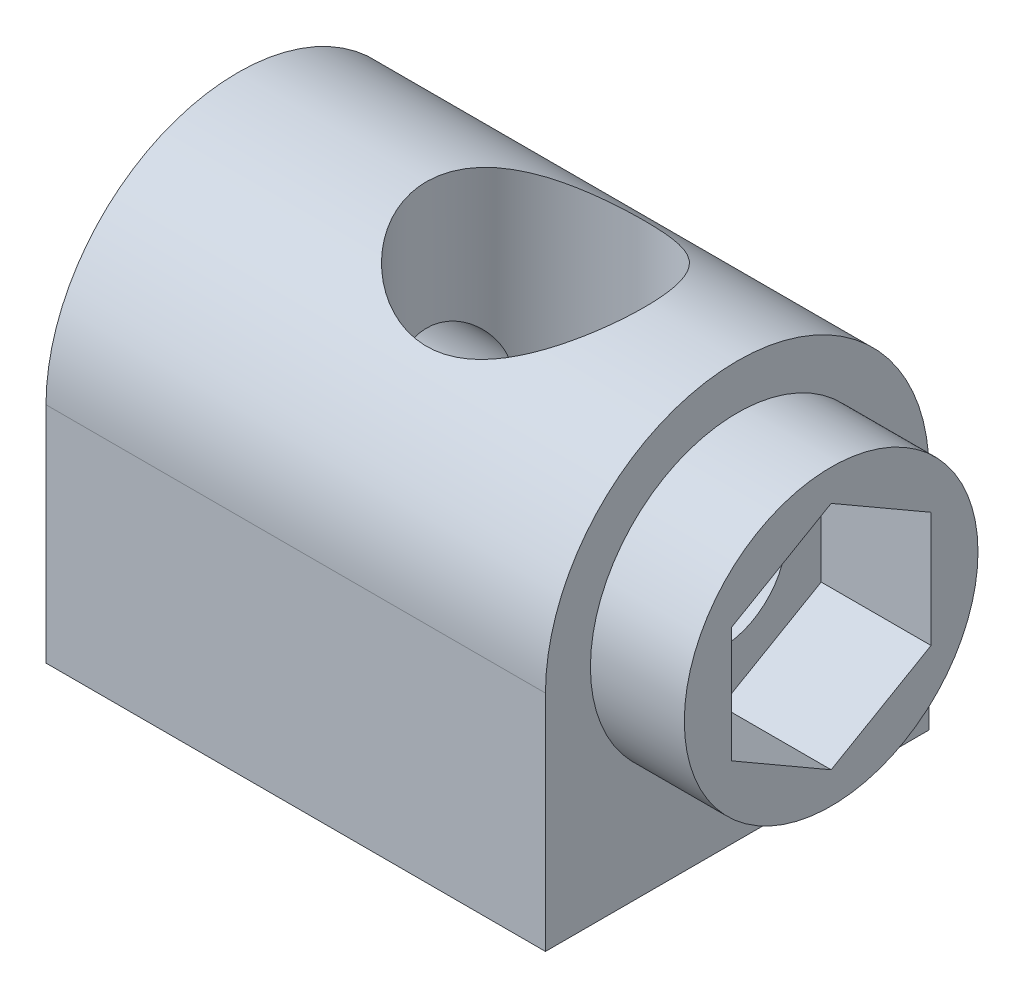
SolidWorks part; units mm, degrees
ref_plane "Front Plane" through (0, 0, 0) normal (0, 0, 1) x (1, 0, 0)
ref_plane "Top Plane" through (0, 0, 0) normal (0, 1, 0) x (1, 0, 0)
ref_plane "Right Plane" through (0, 0, 0) normal (1, 0, 0) x (0, 0, -1)
sketch "Sketch1" plane through (0, 0, 0) normal (1, 0, 0) x (0, 0, -1)
  line L0 (-9.6, 0) -> (9.6, 0)
  line L1 (9.6, 0) -> (9.6, 11.2)
  line L2 (-9.6, 11.2) -> (-9.6, 0)
  arc A0 (9.6, 11.2) -> (-9.6, 11.2) centre (0, 11.2) ccw
  point P4 (0, 0)
  dimension "D1" = 19.2
  dimension "D2" = 20.8
extrude "Boss-Extrude1" add sketch "Sketch1" along normal blind 25
sketch "Sketch2" plane through (25, 0, 0) normal (1, 0, 0) x (0, 0, -1)
  circle A0 centre (0, 11.2) radius 7.35
  dimension "D1" = 14.7
extrude "Boss-Extrude2" add sketch "Sketch2" along normal blind 4.7
sketch "Sketch3" plane through (0, 0, 0) normal (-1, 0, 0) x (0, 0, 1)
  circle A0 centre (0, 11.2) radius 4.9
  dimension "D1" = 9.8
extrude "Cut-Extrude2" cut sketch "Sketch3" against normal blind 5
sketch "Sketch4" plane through (29.7, 0, 0) normal (1, 0, 0) x (0, 0, -1)
  line L1 (0, 5.4265) -> (5, 8.3132)
  line L2 (5, 8.3132) -> (5, 14.0868)
  line L3 (5, 14.0868) -> (0, 16.9735)
  line L4 (0, 16.9735) -> (-5, 14.0868)
  line L5 (-5, 14.0868) -> (-5, 8.3132)
  line L6 (-5, 8.3132) -> (0, 5.4265)
  circle A0 centre (0, 11.2) radius 5 construction
  dimension "D1" = 10
extrude "Cut-Extrude3" cut sketch "Sketch4" against normal blind 5.5
sketch "Sketch5" plane through (5, 0, 0) normal (-1, 0, 0) x (0, 0, 1)
  circle A0 centre (0, 11.2) radius 3.25
  dimension "D1" = 6.5
extrude "Cut-Extrude4" cut sketch "Sketch5" against normal through all
sketch "Sketch6" plane through (0, 0, 0) normal (0, -1, 0) x (1, 0, 0)
  line L0 (25, -7.35) -> (25, 7.35) construction
  circle A0 centre (14.9, 0) radius 3.4
  dimension "D1" = 6.8
  dimension "D2" = 10.1
extrude "Cut-Extrude5" cut sketch "Sketch6" against normal through all
sketch "Sketch7" plane through (0, 0, 0) normal (0, -1, 0) x (1, 0, 0)
  circle A0 centre (14.9, 0) radius 5.45
  dimension "D1" = 10.9
extrude "Cut-Extrude6" cut sketch "Sketch7" against normal through all from offset 4
sketch "Sketch8" plane through (0, 0, 0) normal (0, -1, 0) x (1, 0, 0)
  line L0 (0, 9.6) -> (0, -9.6) construction
  line L1 (3, 4) -> (11, 4)
  line L2 (3, 4) -> (3, -4)
  line L3 (3, -4) -> (11, -4)
  line L4 (11, 4) -> (11, -4)
  line L5 (19, 4) -> (21.8, 4)
  line L6 (19, 4) -> (19, -4)
  line L7 (19, -4) -> (21.8, -4)
  line L8 (21.8, 4) -> (21.8, -4)
  point P8 (3, 0)
  point P10 (19, 0)
  dimension "D1" = 8
  dimension "D2" = 8
  dimension "D3" = 8
  dimension "D4" = 2.8
  dimension "D5" = 11
  dimension "D6" = 18.8
extrude "Boss-Extrude3" add sketch "Sketch8" along normal blind 3
